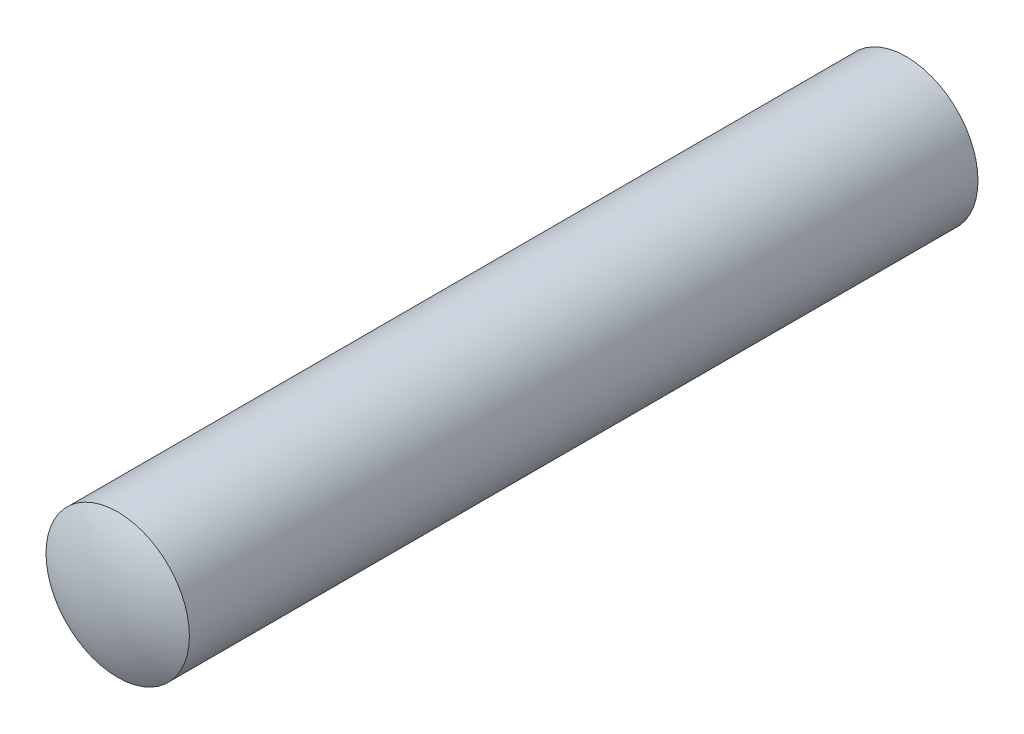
SolidWorks part; units mm, degrees
ref_plane "Plan de face" through (0, 0, 0) normal (0, 0, 1) x (1, 0, 0)
ref_plane "Plan de dessus" through (0, 0, 0) normal (0, 1, 0) x (1, 0, 0)
ref_plane "Plan de droite" through (0, 0, 0) normal (1, 0, 0) x (0, 0, -1)
sketch "Esquisse1" plane through (0, 0, 0) normal (0, 0, 1) x (1, 0, 0)
  circle A0 centre (0, 0) radius 2
  dimension "D1" = 4
extrude "Extrusion1" add sketch "Esquisse1" along normal blind 22
sketch "Esquisse2" plane through (0, 0, 0) normal (0, 1, 0) x (1, 0, 0)
  line L0 (-4.0177, 0.5) -> (3.5179, 0.5) construction
  line L1 (2, 0) -> (-2, 0) construction
  line L2 (0, 0.5) -> (0, 0)
  line L3 (0, 0) -> (-2, 0)
  line L4 (0, 0) -> (0, 1.4943) construction
  arc A0 (-2, 0) -> (0, 0.5) centre (0, -3.75) cw
  dimension "D1" = 0.5
revolve "Révolution1" add sketch "Esquisse2" angle 360 about L4
ref_plane "Plan1" through (0, 0, 11) normal (0, 0, 1) x (1, 0, 0)
mirror "Symétrie1" about plane through (0, 0, 11) normal (0, 0, 1) of "Révolution1"
